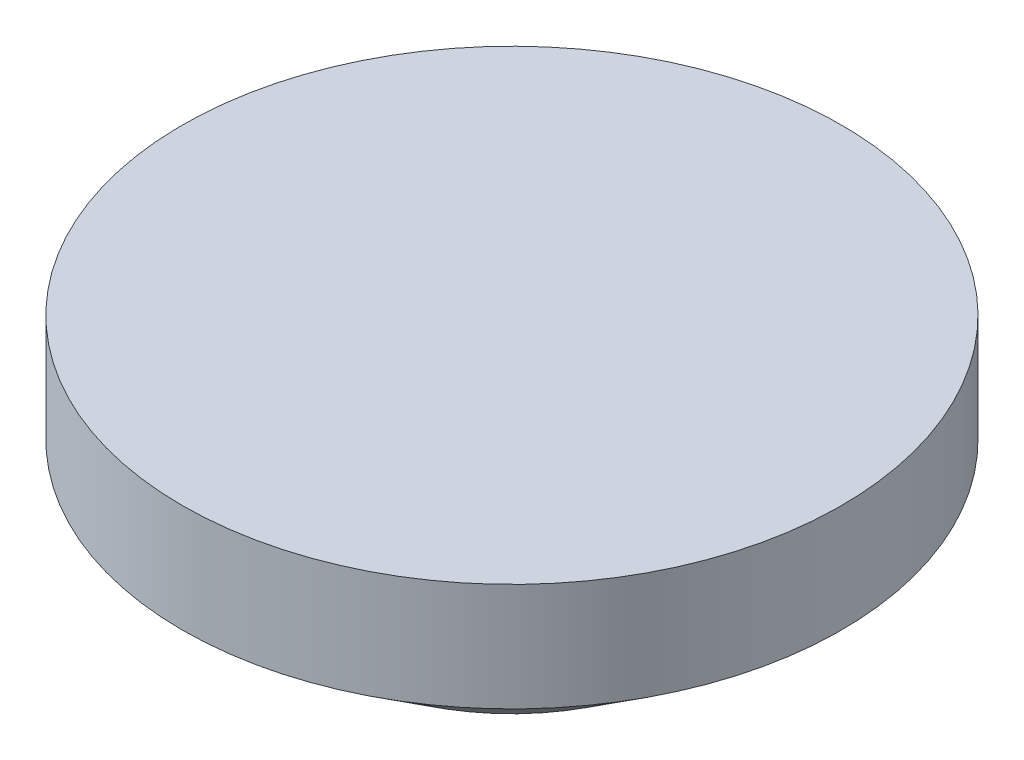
SolidWorks part; units mm, degrees
ref_plane "前视基准面" through (0, 0, 0) normal (0, 0, 1) x (1, 0, 0)
ref_plane "上视基准面" through (0, 0, 0) normal (0, 1, 0) x (1, 0, 0)
ref_plane "右视基准面" through (0, 0, 0) normal (1, 0, 0) x (0, 0, -1)
sketch "草图1" plane through (0, 0, 0) normal (0, 0, 1) x (1, 0, 0)
  line L0 (0, 710) -> (0, 0)
  line L1 (0, 710) -> (1100, 710)
  line L2 (1100, 710) -> (1100, 350)
  line L3 (1100, 350) -> (625, 0)
  line L4 (625, 0) -> (0, 0)
  line L5 (0, 0) -> (0, 845.7664) construction
  dimension "D1" = 2200
  dimension "D2" = 1250
  dimension "D3" = 350
  dimension "D4" = 360
revolve "旋转1" add sketch "草图1" angle 360 about L0
